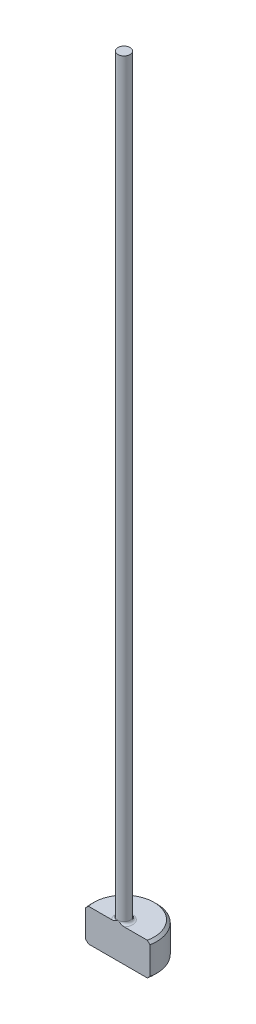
SolidWorks part; units mm, degrees
ref_plane "Front Plane" through (0, 0, 0) normal (0, 0, 1) x (1, 0, 0)
ref_plane "Top Plane" through (0, 0, 0) normal (0, 1, 0) x (1, 0, 0)
ref_plane "Right Plane" through (0, 0, 0) normal (1, 0, 0) x (0, 0, -1)
sketch "Sketch1" plane through (0, 0, 0) normal (0, 0, 1) x (1, 0, 0)
  line L0 (0, 259.9588) -> (0, -15.1925) construction
  line L1 (0, 0) -> (-3.175, 0)
  line L2 (-3.175, 0) -> (-3.175, 3.175)
  line L3 (-3.175, 3.175) -> (-0.5944, 3.175)
  line L4 (-0.5944, 3.175) -> (-0.5944, 76.2)
  line L5 (-0.5944, 76.2) -> (0, 76.2)
  line L6 (0, 76.2) -> (0, 0)
  dimension "L" = 76.2
  dimension "H" = 6.35
  dimension "T" = 3.175
  dimension "D" = 1.1887
revolve "Revolve1" add sketch "Sketch1" angle 360 about L0
chamfer "Chamfer1" distance 0.254 angle 45 2 edges at (0, 3.175, 3.175) (0, 0, 3.175)
fillet "Fillet1" radius 0.254 1 edges at (0, 3.175, 0.5944)
sketch "Sketch2" plane through (0, 0, 0) normal (0, 1, 0) x (1, 0, 0)
  line L0 (-3.1189, -0.5944) -> (3.1189, -0.5944)
  circle A0 centre (0, 0) radius 3.175 construction
  arc A1 (-3.1189, -0.5944) -> (3.1189, -0.5944) centre (0, 0) ccw
  circle A3 centre (0, 0) radius 0.5944 construction
  dimension "D1" = 0
extrude "Key" cut sketch "Sketch2" along normal through all
sketch "Pocket Sketch" plane through (0, 0, 0) normal (0, 0, 1) x (1, 0, 0)
  line L0 (-3.5719, 0) -> (-3.5719, 3.2004)
  line L1 (-3.5719, 3.2004) -> (-1.5548, 3.2004)
  line L2 (-0.7928, 3.9624) -> (-0.7928, 22.225)
  line L3 (-0.7928, 22.225) -> (0, 22.225)
  line L4 (0, 22.225) -> (0, 0)
  line L5 (0, 0) -> (-3.5719, 0)
  line L6 (0, 12.6104) -> (0, -2.4989) construction
  line L7 (-3.175, 2.921) -> (-3.175, 0.254) construction
  line L8 (2.921, 3.175) -> (-2.921, 3.175) construction
  line L9 (-0.5944, 76.2) -> (-0.5944, 3.429) construction
  line L10 (-1.5548, 3.2004) -> (-0.7928, 3.9624)
  point P3 (-0.7928, 3.2004)
  dimension "D1" = 7.1437
  dimension "D2" = 0.3969
  dimension "D3" = 0.0254
  dimension "D4" = 0.1984
  dimension "D5" = 1.5856
  dimension "D6" = 22.225
